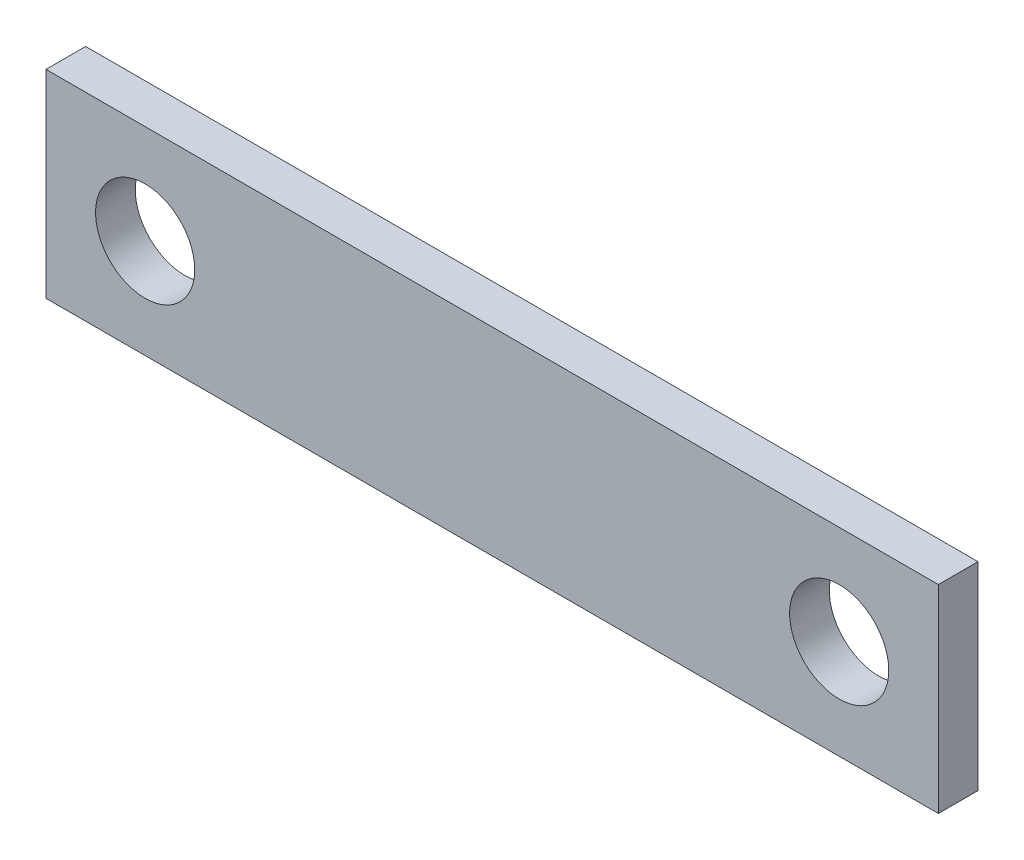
SolidWorks part; units mm, degrees
ref_plane "Plan de face" through (0, 0, 0) normal (0, 0, 1) x (1, 0, 0)
ref_plane "Plan de dessus" through (0, 0, 0) normal (0, 1, 0) x (1, 0, 0)
ref_plane "Plan de droite" through (0, 0, 0) normal (1, 0, 0) x (0, 0, -1)
sketch "Esquisse1" plane through (0, 0, 0) normal (0, 0, 1) x (1, 0, 0)
  line L1 (0, 0) -> (180, 0)
  line L2 (0, 0) -> (0, 40)
  line L3 (0, 40) -> (180, 40)
  line L4 (180, 0) -> (180, 40)
  circle A0 centre (20, 20) radius 10
  circle A1 centre (160, 20) radius 10
  dimension "D3" = 20
  dimension "D5" = 20
  dimension "D6" = 20
  dimension "D7" = 20
  dimension "D8" = 20
  dimension "D1" = 180
  dimension "D2" = 40
  dimension "D4" = 20
extrude "Extrusion1" add sketch "Esquisse1" along normal blind 8
